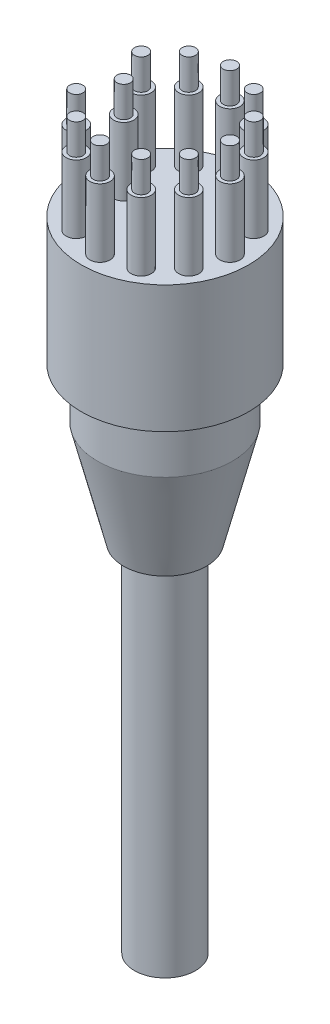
SolidWorks part; units mm, degrees
ref_plane "Front" through (0, 0, 0) normal (0, 0, 1) x (1, 0, 0)
ref_plane "Top" through (0, 0, 0) normal (0, 1, 0) x (1, 0, 0)
ref_plane "Right" through (0, 0, 0) normal (1, 0, 0) x (0, 0, -1)
sketch "Sketch1" plane through (0, 0, 0) normal (0, 1, 0) x (1, 0, 0)
  line L3 (-5.9575, 10.3188) -> (-11.9151, 0) construction
  line L4 (-11.9151, 0) -> (-5.9575, -10.3188) construction
  line L7 (5.9575, 10.3188) -> (-5.9575, 10.3188)
  line L8 (11.9151, 0) -> (5.9575, 10.3188)
  line L9 (5.9575, -10.3188) -> (11.9151, 0)
  line L10 (-5.9575, -10.3188) -> (5.9575, -10.3188)
  circle A0 centre (0, 0) radius 10.0584
  dimension "D1" = 20.1168
extrude "Extrude1" add sketch "Sketch1" along normal blind 7.62
sketch "Sketch3" plane through (0, 7.62, 0) normal (0, 1, 0) x (-1, 0, 0)
  circle A0 centre (0, 0) radius 12.5
  dimension "D1" = 25
extrude "Extrude3" add sketch "Sketch3" along normal blind 19
sketch "Sketch7" plane through (0, 26.62, 0) normal (0, 1, 0) x (-1, 0, 0)
  circle A0 centre (-9.7063, 0) radius 1.5113
  dimension "D1" = 3.0226
  dimension "D2" = 9.7063
extrude "Extrude5" add sketch "Sketch7" along normal blind 10.16
sketch "Sketch8" plane through (0, 36.78, 0) normal (0, 1, 0) x (-1, 0, 0)
  circle A0 centre (-9.7063, 0) radius 1.0033
  dimension "D1" = 2.0066
extrude "Extrude6" add sketch "Sketch8" along normal blind 4.572
pattern_circular "CirPattern1" count 12 over 360 about axis through (0, 0, 0) along (0, 1, 0) of "Extrude6", "Extrude5"
sketch "Sketch11" plane through (0, 26.62, 0) normal (0, 1, 0) x (1, 0, 0)
  circle A0 centre (-6.1675, 0) radius 1.5113
  dimension "D1" = 3.0226
extrude "Extrude9" add sketch "Sketch11" along normal blind 10.16
sketch "Sketch12" plane through (0, 36.78, 0) normal (0, 1, 0) x (1, 0, 0)
  circle A0 centre (-6.1675, 0) radius 1.0033
  dimension "D1" = 2.0066
extrude "Extrude10" add sketch "Sketch12" along normal blind 4.572
sketch "Sketch4" plane through (0, 0, 0) normal (0, -1, 0) x (1, 0, 0)
  circle A0 centre (0, 0) radius 10.0584
  circle A1 centre (0, 0) radius 10.0584 construction
extrude "Extrude4" add sketch "Sketch4" along normal blind 15.5194 draft 14
sketch "Sketch5" plane through (0, -15.5194, 0) normal (0, -1, 0) x (1, 0, 0)
  circle A0 centre (0, 0) radius 4.572
  dimension "D1" = 9.144
extrude "Cable" add sketch "Sketch5" along normal blind 53.1313
sketch "Sketch13" plane through (0, 0, 0) normal (0, 0, 1) x (1, 0, 0)
  line L0 (0, 0) -> (0, 46.9314) construction
  line L1 (0, 0) -> (0, -15.5194) construction
  line L2 (12.7, 7.62) -> (12.7, 6.477)
  line L3 (12.7, 6.477) -> (16.383, 6.477)
  line L4 (16.383, 6.477) -> (16.383, 30.3567)
  line L5 (16.383, 30.3567) -> (14.3637, 30.3567)
  line L6 (14.3637, 30.3567) -> (14.3637, 31.8807)
  line L7 (14.3637, 31.8807) -> (14.7955, 31.8807)
  line L8 (14.7955, 31.8807) -> (14.7955, 33.2777)
  line L9 (14.7955, 33.2777) -> (14.3637, 33.2777)
  line L10 (14.3637, 33.2777) -> (14.3637, 34.8017)
  line L11 (14.3637, 34.8017) -> (14.7955, 34.8017)
  line L12 (14.7955, 34.8017) -> (14.7955, 36.1987)
  line L13 (14.7955, 36.1987) -> (14.3637, 36.1987)
  line L14 (14.3637, 36.1987) -> (14.3637, 37.7227)
  line L15 (14.3637, 37.7227) -> (14.7955, 37.7227)
  line L16 (14.7955, 37.7227) -> (14.7955, 39.1197)
  line L17 (14.7955, 39.1197) -> (14.3637, 39.1197)
  line L18 (14.3637, 39.1197) -> (14.3637, 40.6437)
  line L19 (14.3637, 43.0567) -> (12.7635, 43.0567)
  line L20 (12.7635, 43.0567) -> (12.7635, 7.62)
  line L21 (12.7635, 7.62) -> (12.7, 7.62)
  line L22 (14.3637, 40.6437) -> (14.7955, 40.6437)
  line L23 (14.7955, 40.6437) -> (14.7955, 42.0407)
  line L24 (14.7955, 42.0407) -> (14.3637, 42.0407)
  line L25 (14.3637, 42.0407) -> (14.3637, 43.0567)
  dimension "D1" = 23.8797
  dimension "D2" = 12.7
  dimension "D3" = 1.397
  dimension "D4" = 1.524
  dimension "D5" = 28.7274
  dimension "D6" = 29.591
  dimension "D7" = 25.527
  dimension "D8" = 25.4
  dimension "D9" = 1.143
  dimension "D10" = 32.766
revolve "DLSA-M" [suppressed] add sketch "Sketch13" angle 360 about L0
sketch "Sketch14" [suppressed] plane through (0, 30.3567, 0) normal (0, -1, 0) x (1, 0, 0)
  arc A0 (1.1296, 16.344) -> (-1.1296, 16.344) centre (0, 16.383) ccw
  circle A1 centre (0, 0) radius 16.383 construction
  arc A2 (1.1296, 16.344) -> (-1.1296, 16.344) centre (0, 0) ccw
  dimension "D1" = 2.2606
extrude "Extrude11" [suppressed] add sketch "Sketch14" along normal blind 22.0345
pattern_circular "CirPattern3" [suppressed] count 8 over 360
